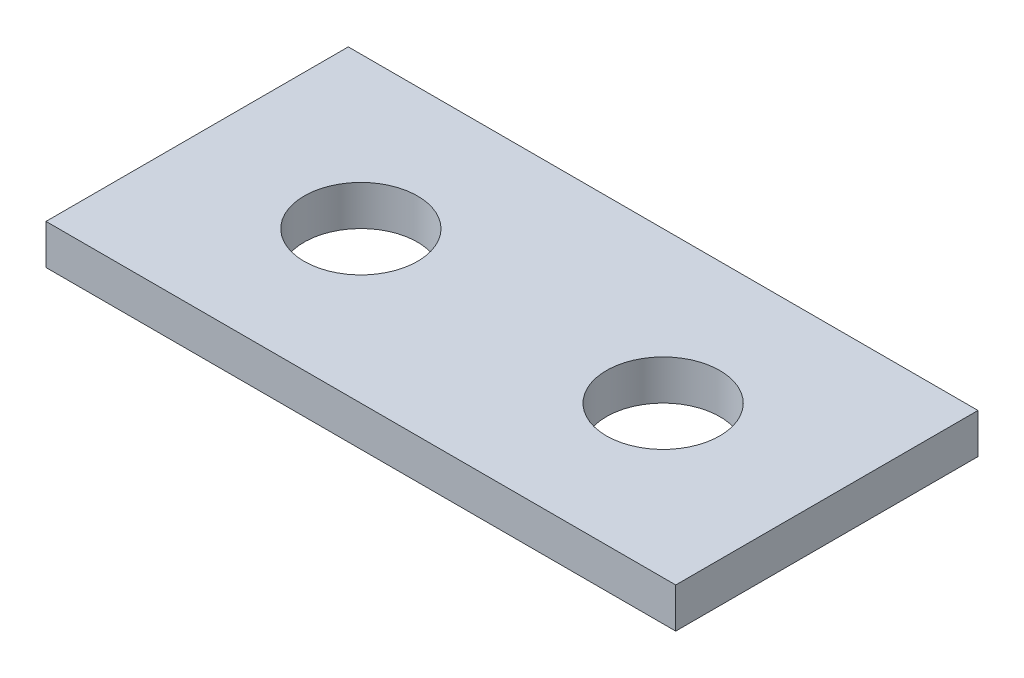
SolidWorks part; units mm, degrees
ref_plane "Front Plane" through (0, 0, 0) normal (0, 0, 1) x (1, 0, 0)
ref_plane "Top Plane" through (0, 0, 0) normal (0, 1, 0) x (1, 0, 0)
ref_plane "Right Plane" through (0, 0, 0) normal (1, 0, 0) x (0, 0, -1)
sketch "Sketch1" plane through (0, 0, 0) normal (0, 1, 0) x (1, 0, 0)
  line L1 (-25, 12) -> (25, 12)
  line L2 (-25, 12) -> (-25, -12)
  line L3 (-25, -12) -> (25, -12)
  line L4 (25, 12) -> (25, -12)
  line L5 (-25, 12) -> (25, -12) construction
  line L6 (-25, -12) -> (25, 12) construction
  point P0 (0, 0)
  dimension "D1" = 50
  dimension "D2" = 24
extrude "Extrude1" add sketch "Sketch1" along normal blind 3.175
sketch "Sketch5" plane through (0, 3.175, 0) normal (0, 1, 0) x (1, 0, 0)
  line L0 (0, 6.5238) -> (0, -12) construction
  line L1 (-25, -12) -> (25, -12) construction
hole_wizard "M8 Clearance Hole1" positions "3DSketch1" profile "Sketch4" hole size "M8" standard "Ansi Metric"
sketch3d "3DSketch1"
  line L0 (25, 3.175, -12) -> (-25, 3.175, -12) construction
  line L1 (0, 3.175, -6.5238) -> (0, 3.175, 12) construction
  point P0 (-12, 3.175, 0)
  dimension "D1" = 12
  dimension "D2" = 12
sketch "Sketch4" plane through (-12, 3.175, 0) normal (1, 0, 0) x (0, 0, 1)
  line L0 (0, 0) -> (0, 3.175)
  line L1 (0, 3.175) -> (4.5, 3.175)
  line L2 (4.5, 3.175) -> (4.5, 0)
  line L5 (4.5, 0) -> (0, 0)
  line L11 (0, -6.35) -> (0, 107.95) construction
  dimension "Thru Hole Dia." = 9
  dimension "Thru Hole Depth" = 3.175
mirror "Mirror1" about plane through (0, 0, 0) normal (1, 0, 0) of "M8 Clearance Hole1"
